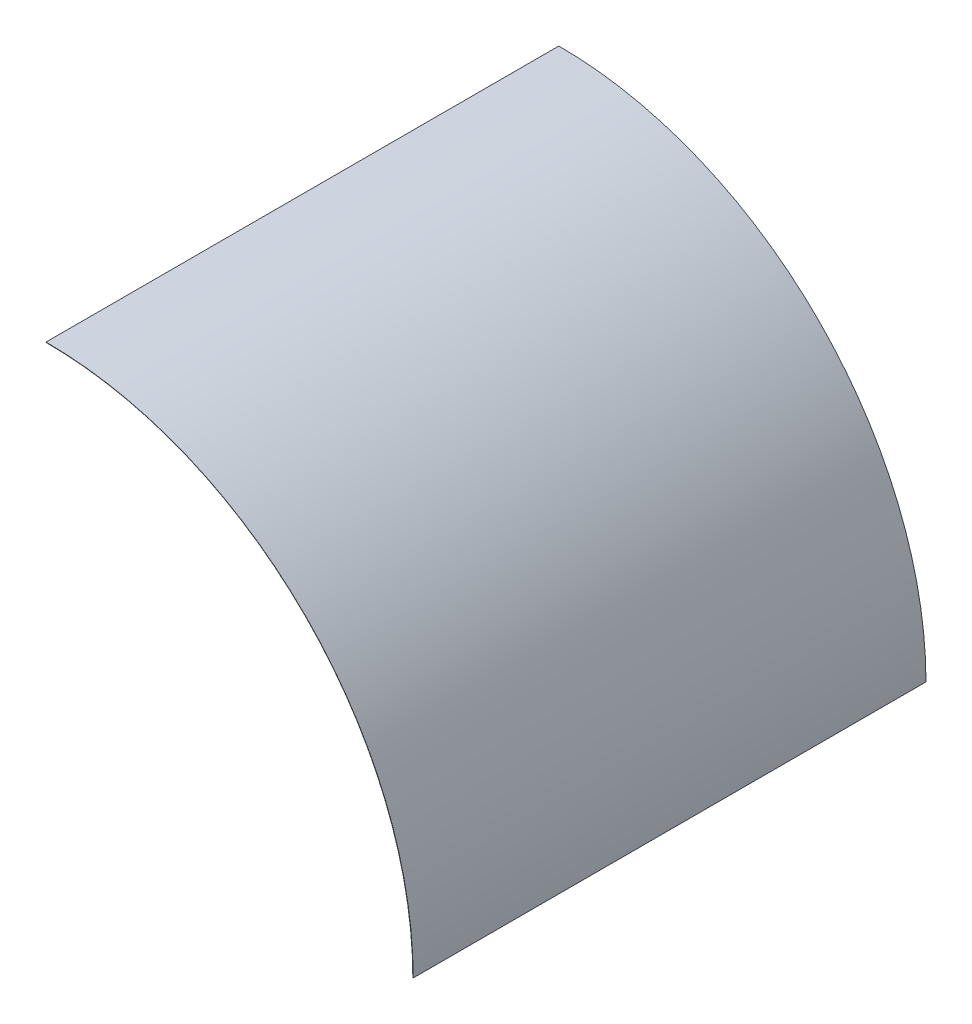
SolidWorks part; units mm, degrees
ref_plane "Front Plane" through (0, 0, 0) normal (0, 0, 1) x (1, 0, 0)
ref_plane "Top Plane" through (0, 0, 0) normal (0, 1, 0) x (1, 0, 0)
ref_plane "Right Plane" through (0, 0, 0) normal (1, 0, 0) x (0, 0, -1)
sketch "Sketch1" plane through (0, 0, 0) normal (0, 0, 1) x (1, 0, 0)
  line L0 (0, 0) -> (0, 45.174) construction
  line L1 (0, 0) -> (40.8023, 0) construction
  line L2 (0, 2148) -> (0, 2146)
  line L3 (2148, 0) -> (2146, 0)
  arc A0 (0, 2146) -> (2146, 0) centre (0, 0) cw
  arc A1 (0, 2148) -> (2148, 0) centre (0, 0) cw
  dimension "D1" = 2146
  dimension "D2" = 2
extrude "Boss-Extrude1" add sketch "Sketch1" against normal blind 3000
